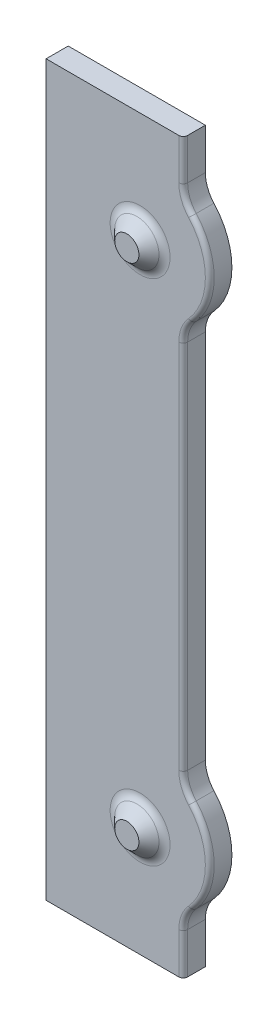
SolidWorks part; units mm, degrees
ref_plane "Front" through (0, 0, 0) normal (0, 0, 1) x (1, 0, 0)
ref_plane "Top" through (0, 0, 0) normal (0, 1, 0) x (1, 0, 0)
ref_plane "Right" through (0, 0, 0) normal (1, 0, 0) x (0, 0, -1)
sketch "Sketch1" plane through (0, 0, 0) normal (0, 0, 1) x (1, 0, 0)
  line L0 (0, 0) -> (4.953, 0) construction
  line L1 (-10.795, 41.8436) -> (4.953, 41.8436)
  line L2 (-10.795, 41.8436) -> (-10.795, -41.8436)
  line L3 (-10.795, -41.8436) -> (4.953, -41.8436)
  line L4 (4.953, 41.8436) -> (4.953, 35.4936)
  line L5 (4.953, -35.4936) -> (4.953, -41.8436)
  line L6 (4.953, 22.9264) -> (4.953, -22.9264)
  line L7 (8.001, 29.21) -> (1.905, 29.21) construction
  line L8 (8.001, 7.454) -> (-10.795, 7.454) construction
  arc A0 (4.953, 35.4936) -> (4.953, 22.9264) centre (0, 29.21) cw
  arc A1 (4.953, -35.4936) -> (4.953, -22.9264) centre (0, -29.21) ccw
  point P15 (4.953, 29.21)
  point P18 (-1.397, 7.454)
  dimension "D1" = 3.048
  dimension "D4" = 16.002
  dimension "D3" = 58.42
  dimension "D2" = 6.35
  dimension "D5" = 6.35
extrude "Boss-Extrude1" add sketch "Sketch1" along normal blind 2.54
fillet "Fillet1" radius 3.81 4 edges at (4.953, 35.4936, 1.27) (4.953, 22.9264, 1.27) (4.953, -22.9264, 1.27) (4.953, -35.4936, 1.27)
fillet "Fillet2" radius 0.508 9 edges at (4.953, -39.4863, 2.54) (5.2073, -35.7603, 2.54) (8.001, -29.21, 2.54) (5.2073, -22.6597, 2.54) (4.953, 0, 2.54) (5.2073, 22.6597, 2.54) (4.953, 39.4863, 2.54) (5.2073, 35.7603, 2.54) (8.001, 29.21, 2.54)
ref_plane "Plane1" through (0, 29.21, 0) normal (0, 1, 0) x (1, 0, 0)
sketch "Sketch2" plane through (0.7156, 29.21, 2.3764) normal (0, 1, 0) x (-1, 0, 0)
  line L0 (0.7156, 0.1636) -> (0.7156, 1.6876)
  line L1 (0.7156, 1.6876) -> (-0.6735, 1.6876)
  line L2 (-0.6735, 1.6876) -> (-2.1975, 0.1636)
  line L3 (-2.1975, 0.1636) -> (0.7156, 0.1636)
  line L5 (0.7156, 1.6876) -> (0.7156, 5.6677) construction
  line L6 (-3.7294, 0.1636) -> (11.5106, 0.1636) construction
  dimension "D1" = 45
  dimension "D2" = 1.524
  dimension "D3" = 2.7781
revolve "Revolve1" add sketch "Sketch2" angle 360 about L5
fillet "Fillet3" radius 1.27 1 edges at (-2.9131, 29.21, 2.54)
mirror "Mirror1" about plane through (0, 0, 0) normal (0, 1, 0) of "Fillet3", "Revolve1"
sketch "Orientation Sketch" plane through (0, 0, 0) normal (0, 0, -1) x (-1, 0, 0)
  line L30 (10.795, 41.8436) -> (10.795, -41.8436) construction
  line L31 (-4.953, 41.8436) -> (10.795, 41.8436) construction
  line L32 (-4.953, 37.1289) -> (-4.953, 41.8436) construction
  line L33 (-4.953, -21.2911) -> (-4.953, 21.2911) construction
  line L34 (-4.953, -41.8436) -> (-4.953, -37.1289) construction
  line L35 (10.795, -41.8436) -> (-4.953, -41.8436) construction
  line L36 (10.795, 41.8436) -> (10.795, -41.8436)
  line L37 (-4.953, 41.8436) -> (10.795, 41.8436)
  line L38 (-4.953, 37.1289) -> (-4.953, 41.8436)
  line L39 (-4.953, -21.2911) -> (-4.953, 21.2911)
  line L40 (-4.953, -41.8436) -> (-4.953, -37.1289)
  line L41 (10.795, -41.8436) -> (-4.953, -41.8436)
  arc A30 (-5.9362, 34.5744) -> (-4.953, 37.1289) centre (-8.763, 37.1289) ccw construction
  arc A31 (-5.9362, 34.5744) -> (-5.9362, 23.8456) centre (0, 29.21) ccw construction
  arc A32 (-4.953, 21.2911) -> (-5.9362, 23.8456) centre (-8.763, 21.2911) ccw construction
  arc A33 (-5.9362, -23.8456) -> (-4.953, -21.2911) centre (-8.763, -21.2911) ccw construction
  arc A34 (-5.9362, -23.8456) -> (-5.9362, -34.5744) centre (0, -29.21) ccw construction
  arc A35 (-4.953, -37.1289) -> (-5.9362, -34.5744) centre (-8.763, -37.1289) ccw construction
  arc A36 (-5.9362, 34.5744) -> (-4.953, 37.1289) centre (-8.763, 37.1289) ccw
  arc A37 (-5.9362, 34.5744) -> (-5.9362, 23.8456) centre (0, 29.21) ccw
  arc A38 (-4.953, 21.2911) -> (-5.9362, 23.8456) centre (-8.763, 21.2911) ccw
  arc A39 (-5.9362, -23.8456) -> (-4.953, -21.2911) centre (-8.763, -21.2911) ccw
  arc A40 (-5.9362, -23.8456) -> (-5.9362, -34.5744) centre (0, -29.21) ccw
  arc A41 (-4.953, -37.1289) -> (-5.9362, -34.5744) centre (-8.763, -37.1289) ccw
other "FormTool1"
